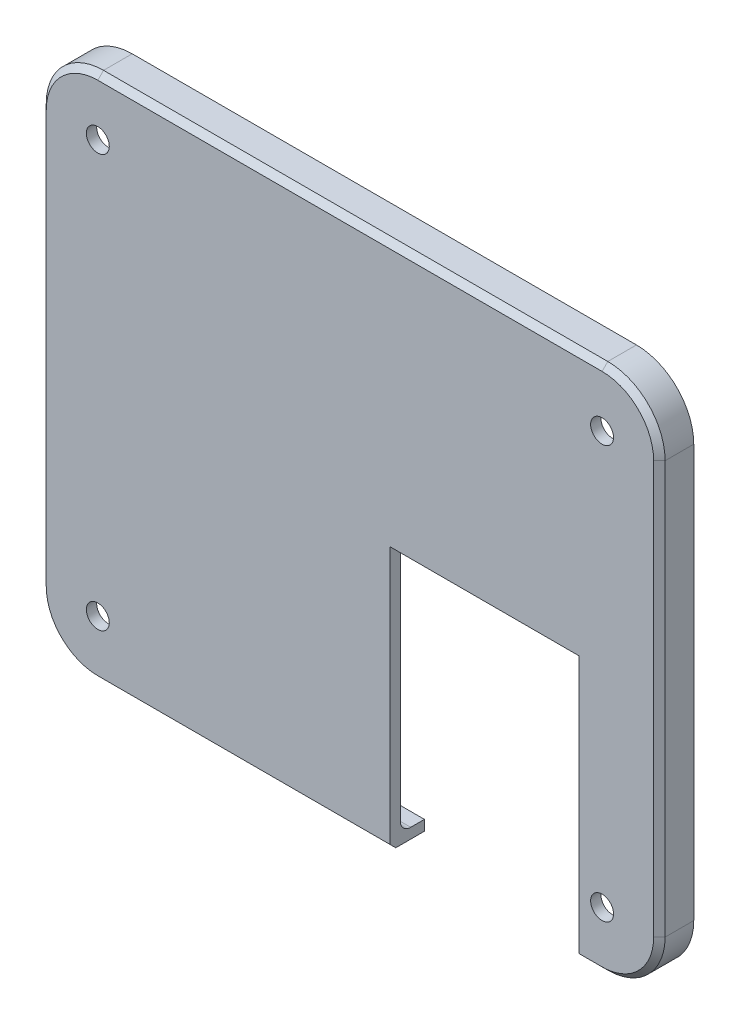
SolidWorks part; units mm, degrees
ref_plane "Plan de face" through (0, 0, 0) normal (0, 0, 1) x (1, 0, 0)
ref_plane "Plan de dessus" through (0, 0, 0) normal (0, 1, 0) x (1, 0, 0)
ref_plane "Plan de droite" through (0, 0, 0) normal (1, 0, 0) x (0, 0, -1)
sketch "Esquisse1" plane through (0, 0, 0) normal (0, 0, 1) x (1, 0, 0)
  line L0 (-44, -36) -> (44, 36) construction
  line L2 (44, -46) -> (-44, -46)
  line L3 (54, -36) -> (54, 36)
  line L4 (44, 46) -> (-44, 46)
  line L5 (-54, -36) -> (-54, 36)
  line L6 (54, -46) -> (-54, 46) construction
  line L7 (54, 46) -> (-54, -46) construction
  circle A0 centre (-44, -36) radius 2
  circle A1 centre (44, -36) radius 2
  circle A2 centre (44, 36) radius 2
  circle A3 centre (-44, 36) radius 2
  arc A4 (-54, -36) -> (-44, -46) centre (-44, -36) ccw
  arc A5 (44, -46) -> (54, -36) centre (44, -36) ccw
  arc A6 (54, 36) -> (44, 46) centre (44, 36) ccw
  arc A7 (-44, 46) -> (-54, 36) centre (-44, 36) ccw
  point P2 (0, 0)
  point P4 (0, 0)
  dimension "D3" = 72
  dimension "D5" = 10
  dimension "D6" = 4
  dimension "D4" = 88
  dimension "D1" = 2
  dimension "D2" = 2
extrude "Boss.-Extru.1" add sketch "Esquisse1" along normal blind 6
shell "Coque1" thickness 1.8
sketch "Esquisse2" plane through (0, 0, 6) normal (0, 0, 1) x (1, 0, 0)
  line L0 (-44, -46) -> (44, -46) construction
  line L1 (7, -46) -> (40, -46)
  line L2 (7, -46) -> (7, 0)
  line L3 (7, 0) -> (40, 0)
  line L4 (40, -46) -> (40, 0)
  line L6 (54, -36) -> (54, 36) construction
  dimension "D1" = 46
  dimension "D2" = 33
  dimension "D3" = 47
extrude "Enlèv. mat.-Extru.1" cut sketch "Esquisse2" against normal through all
chamfer "Chanfrein1" distance 1 angle 45 9 edges at (42, -46, 6) (-18.5, -46, 6) (51.0711, -43.0711, 6) (-51.0711, -43.0711, 6) (54, 0, 6) (-54, 0, 6) (51.0711, 43.0711, 6) (-51.0711, 43.0711, 6) (0, 46, 6)
fillet "Congé1" radius 1.8 9 edges at (42, -44.2, 4.2) (49.7983, -41.7983, 4.2) (52.2, 0, 4.2) (49.7983, 41.7983, 4.2) (-18.5, -44.2, 4.2) (-49.7983, -41.7983, 4.2) (-52.2, 0, 4.2) (-49.7983, 41.7983, 4.2) (0, 44.2, 4.2)
